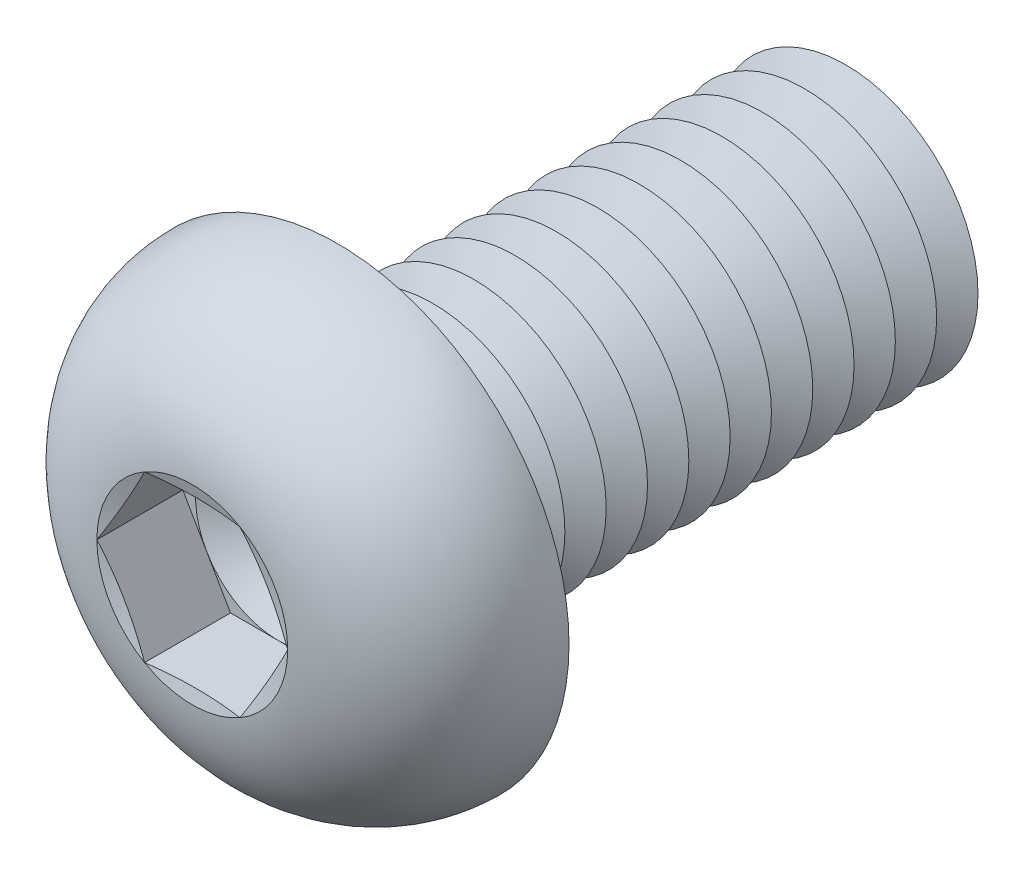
SolidWorks part; units mm, degrees
ref_plane "Front Plane" through (0, 0, 0) normal (0, 0, 1) x (1, 0, 0)
ref_plane "Top Plane" through (0, 0, 0) normal (0, 1, 0) x (1, 0, 0)
ref_plane "Right Plane" through (0, 0, 0) normal (1, 0, 0) x (0, 0, -1)
sketch "Sketch1" plane through (0, 0, 0) normal (1, 0, 0) x (0, 0, -1)
  line L0 (0, 4) -> (0, 7)
  line L3 (0, 4) -> (16, 4)
  line L4 (16, 4) -> (16, 0)
  line L5 (16, 0) -> (-4.4, 0) construction
  line L6 (-4.4, 0) -> (16, 0)
  line L7 (-4.4, 2.8867) -> (-4.4, 1.4434) construction
  line L8 (-4.4, 1.4434) -> (-4.4, 0)
  line L9 (-4.4, 2.8867) -> (-4.0132, 1.4434)
  line L10 (-4.0132, 1.4434) -> (-4.4, 1.4434)
  line L11 (16, 0) -> (22.7481, 0) construction
  line L12 (0, 7) -> (-4.4, 7) construction
  arc A1 (0, 7) -> (-4.4, 2.8867) centre (0, 2.59) ccw
  point P8 (16, 2)
  dimension "D1" = 14
  dimension "D2" = 8
  dimension "D3" = 4.4
  dimension "D4" = 5.7735
  dimension "D5" = 16
  dimension "D6" = 15
revolve "Revolve1" add sketch "Sketch1" angle 360 about L5
fillet "Fillet1" radius 0.625 1 edges at (-4, 0, 0)
sketch "Sketch2" plane through (0, 0, 0) normal (1, 0, 0) x (0, 0, -1)
  line L0 (15.375, 4) -> (16.625, 4)
  line L1 (16, 4) -> (0.625, 4) construction
  line L2 (16.625, 4) -> (16, 2.9175)
  line L3 (16, -4) -> (16, 4) construction
  line L4 (16, 2.9175) -> (15.375, 4)
  dimension "D1" = 1.25
revolve "Cut-Revolve1" cut sketch "Sketch2" angle 360 about axis through (0, 0, -16) along (0, 0, -1)
pattern_linear "LPattern1" count 12 spacing 1.25 along (0, 0, 1) of "Cut-Revolve1"
sketch "Sketch3" plane through (0, 0, 4.4) normal (0, 0, 1) x (1, 0, 0)
  line L7 (1.4434, 2.5) -> (-1.4434, 2.5)
  line L8 (-1.4434, 2.5) -> (-2.8867, 0)
  line L9 (-2.8867, 0) -> (-1.4434, -2.5)
  line L10 (-1.4434, -2.5) -> (1.4434, -2.5)
  line L11 (1.4434, -2.5) -> (2.8867, 0)
  line L12 (2.8867, 0) -> (1.4434, 2.5)
  circle A0 centre (0, 0) radius 2.5 construction
  circle A3 centre (0, 0) radius 2.8867 construction
extrude "Cut-Extrude1" cut sketch "Sketch3" against normal blind 2.6
sketch "Sketch4" plane through (0, 0, 1.8) normal (0, 0, 1) x (1, 0, 0)
  line L1 (1.4434, 2.5) -> (-1.4434, 2.5) construction
  circle A0 centre (0, 0) radius 2.5
extrude "Cut-Extrude2" cut sketch "Sketch4" against normal through all draft 60
